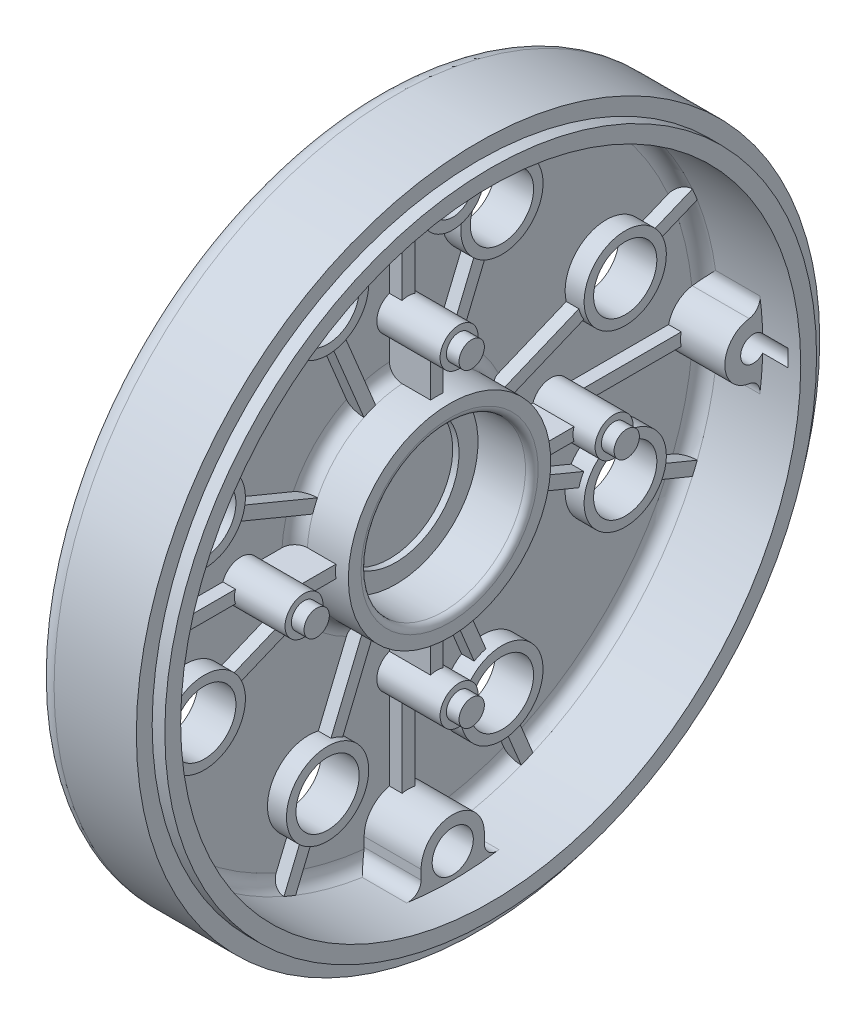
SolidWorks part; units mm, degrees
ref_plane "Plan de face" through (0, 0, 0) normal (0, 0, 1) x (1, 0, 0)
ref_plane "Plan de dessus" through (0, 0, 0) normal (0, 1, 0) x (1, 0, 0)
ref_plane "Plan de droite" through (0, 0, 0) normal (1, 0, 0) x (0, 0, -1)
sketch "Esquisse1" plane through (0, 0, 0) normal (0, 0, 1) x (1, 0, 0)
  line L0 (0, 0) -> (0, 51)
  line L1 (3, 54) -> (16, 54)
  line L2 (16, 54) -> (16, 51.5)
  line L3 (16, 51.5) -> (18, 51.5)
  line L4 (18, 51.5) -> (18, 49)
  line L5 (18, 49) -> (5, 49)
  line L6 (3, 47) -> (3, 18)
  line L7 (5, 16) -> (11.5, 16)
  line L8 (11.5, 16) -> (11.5, 14)
  line L9 (10.5, 13) -> (3, 13)
  line L10 (3, 13) -> (3, 10)
  line L11 (3, 10) -> (2, 10)
  line L12 (2, 10) -> (2, 0)
  line L13 (2, 0) -> (0, 0)
  line L14 (0, 0) -> (60.4258, 0) construction
  arc A0 (0, 51) -> (3, 54) centre (3, 51) cw
  arc A1 (5, 49) -> (3, 47) centre (5, 47) ccw
  arc A2 (3, 18) -> (5, 16) centre (5, 18) ccw
  arc A3 (11.5, 14) -> (10.5, 13) centre (10.5, 14) cw
  point P18 (0, 54)
  dimension "D13" = 3
  dimension "D14" = 2
  dimension "D15" = 1
  dimension "D1" = 108
  dimension "D2" = 103
  dimension "D3" = 16
  dimension "D4" = 18
  dimension "D5" = 15
  dimension "D6" = 6.5
  dimension "D7" = 15
  dimension "D8" = 16
  dimension "D9" = 26
  dimension "D10" = 10
  dimension "D11" = 32
  dimension "D12" = 98
revolve "Révolution1" add sketch "Esquisse1" angle 360 about L14
ref_plane "Plan1" through (12, 0, 0) normal (1, 0, 0) x (0, 0, -1)
sketch "Esquisse2" plane through (12, 0, 0) normal (1, 0, 0) x (0, 0, -1)
  line L0 (-5, 45) -> (-5, 46.4758)
  line L1 (0, 0) -> (0, 45) construction
  line L2 (5, 45) -> (5, 46.4758)
  arc A0 (-5, 45) -> (5, 45) centre (0, 45) ccw
  circle A1 centre (0, 0) radius 49 construction
  arc A2 (7.2979, 48.4535) -> (-7.2979, 48.4535) centre (0, 0) ccw
  arc A3 (-5, 46.4758) -> (-7.2979, 48.4535) centre (-7, 46.4758) ccw
  arc A4 (5, 46.4758) -> (7.2979, 48.4535) centre (7, 46.4758) cw
  point P9 (-5, 48.7442)
  point P12 (5, 48.7442)
  dimension "D1" = 10
  dimension "D2" = 2
  dimension "D3" = 45
extrude "Extrusion1" add sketch "Esquisse2" against normal up to surface (9 mm away)
sketch "Esquisse3" plane through (12, 0, 0) normal (1, 0, 0) x (0, 0, -1)
  circle A0 centre (0, 45) radius 3.25
  dimension "D1" = 6.5
extrude "Enlèv. mat.-Extru.1" cut sketch "Esquisse3" against normal through all
pattern_circular "Répétition circulaire1" count 2 over 360 about axis through (0, 0, 0) along (1, 0, 0) of "Extrusion1", "Enlèv. mat.-Extru.1"
sketch "Esquisse4" plane through (12, 0, 0) normal (1, 0, 0) x (0, 0, -1)
  line L0 (0, 0) -> (-43, 0) construction
  arc A0 (-46.8478, -4.4525) -> (-46.8478, 4.4525) centre (-47.5, 0) ccw
  arc A2 (-48.5391, 6.705) -> (-48.5391, -6.705) centre (0, 0) ccw
  arc A3 (-48.5391, -6.705) -> (-46.8478, -4.4525) centre (-46.5579, -6.4314) cw
  arc A4 (-48.5391, 6.705) -> (-46.8478, 4.4525) centre (-46.5579, 6.4314) ccw
  circle A5 centre (0, 0) radius 49 construction
  dimension "D1" = 9
  dimension "D3" = 2
  dimension "D2" = 47.5
extrude "Extrusion2" add sketch "Esquisse4" against normal up to surface (9 mm away)
hole_wizard "Trou taraudé M51" positions "Esquisse8" profile "Esquisse7" tap size "M5" standard "ISO"
sketch "Esquisse8" plane through (16, 0, 0) normal (1, 0, 0) x (0, 0, -1)
  arc A0 (-46.8478, -4.4525) -> (-46.8478, 4.4525) centre (-47.5, 0) ccw construction
  point P0 (-47.5, 0)
sketch "Esquisse7" plane through (16, 0, 47.5) normal (0, 1, 0) x (0, 0, -1)
  line L0 (0, 0) -> (0, 16)
  line L1 (0, 16) -> (2, 16)
  line L2 (2, 16) -> (2, 0)
  line L5 (2, 0) -> (0, 0)
  line L11 (0, -6.35) -> (0, 107.95) construction
  dimension "Diamètre du trou pour taraudage jusqu'au prochain" = 4
  dimension "Profondeur du trou pour taraudage jusqu'au prochain" = 16
pattern_circular "Répétition circulaire2" count 2 over 360 about axis through (0, 0, 0) along (1, 0, 0) of "Trou taraudé M51", "Extrusion2"
ref_plane "Plan2" through (5, 0, 0) normal (1, 0, 0) x (0, 0, -1)
sketch "Esquisse11" plane through (5, 0, 0) normal (1, 0, 0) x (0, 0, -1)
  line L0 (0, 0) -> (0, 45) construction
  line L1 (0, 0) -> (-20.6649, 49.8895) construction
  line L2 (-18.7515, 45.2701) -> (-6.1229, 14.7821)
  line L3 (18.7515, 45.2701) -> (6.1229, 14.7821)
  line L4 (45.2701, 18.7515) -> (14.7821, 6.1229)
  line L5 (45.2701, -18.7515) -> (14.7821, -6.1229)
  line L6 (18.7515, -45.2701) -> (6.1229, -14.7821)
  line L7 (-18.7515, -45.2701) -> (-6.1229, -14.7821)
  line L8 (-45.2701, -18.7515) -> (-14.7821, -6.1229)
  line L9 (-45.2701, 18.7515) -> (-14.7821, 6.1229)
  circle A0 centre (0, 0) radius 54 construction
  arc A1 (-7.2979, 48.4535) -> (-48.5391, 6.705) centre (0, 0) ccw construction
  circle A2 centre (0, 0) radius 16 construction
  dimension "D1" = 22.5
rib "Nervure1" sketch "Esquisse11" sketch "Esquisse11" thickness 2 extrusion direction normal to sketch draft on no parameters "D1"=2
sketch "Esquisse9" plane through (3, 0, 0) normal (1, 0, 0) x (0, 0, -1)
  line L0 (0, 0) -> (0, 45) construction
  line L1 (0, 0) -> (-20.6649, 49.8895) construction
  circle A0 centre (0, 0) radius 54 construction
  circle A1 centre (-13.7766, 33.2597) radius 6.5
  dimension "D2" = 13
  dimension "D1" = 22.5
  dimension "D3" = 36
extrude "Extrusion3" add sketch "Esquisse9" along normal blind 3
sketch "Esquisse10" plane through (6, 0, 0) normal (1, 0, 0) x (0, 0, -1)
  circle A0 centre (-13.7766, 33.2597) radius 5
  dimension "D1" = 10
extrude "Enlèv. mat.-Extru.2" cut sketch "Esquisse10" against normal through all
pattern_circular "Répétition circulaire3" count 8 over 360 about axis through (0, 0, 0) along (1, 0, 0) of "Enlèv. mat.-Extru.2", "Extrusion3"
sketch "Esquisse12" plane through (5, 0, 0) normal (1, 0, 0) x (0, 0, -1)
  line L0 (0, 40) -> (0, 16)
  line L1 (-43, 0) -> (-16, 0)
  line L2 (0, -40) -> (0, -16)
  line L3 (16, 0) -> (43, 0)
  arc A0 (-5, 45) -> (5, 45) centre (0, 45) ccw construction
  arc A1 (-5, 45) -> (5, 45) centre (0, 45) ccw construction
  circle A2 centre (0, 0) radius 16 construction
  arc A3 (-46.7895, -4.4436) -> (-46.7895, 4.4436) centre (-47.5, 0) ccw construction
  arc A4 (-15.1359, 5.1871) -> (-15.1359, -5.1871) centre (0, 0) ccw construction
  arc A5 (5, -45) -> (-5, -45) centre (0, -45) ccw construction
  arc A6 (15.1359, -5.1871) -> (15.1359, 5.1871) centre (0, 0) ccw construction
  arc A7 (46.8478, 4.4525) -> (46.8478, -4.4525) centre (47.5, 0) ccw construction
rib "Nervure2" sketch "Esquisse12" sketch "Esquisse12" thickness 2 extrusion direction normal to sketch draft on no parameters "D1"=2
sketch "Esquisse13" plane through (3, 0, 0) normal (1, 0, 0) x (0, 0, -1)
  line L0 (0, 0) -> (0, 39.8121) construction
  circle A0 centre (0, 24.5) radius 3
  dimension "D2" = 6
  dimension "D1" = 24.5
extrude "Extrusion4" add sketch "Esquisse13" along normal blind 10
sketch "Esquisse14" plane through (13, 0, 0) normal (1, 0, 0) x (0, 0, -1)
  circle A0 centre (0, 24.5) radius 2
  dimension "D1" = 4
extrude "Extrusion5" add sketch "Esquisse14" along normal blind 2
pattern_circular "Répétition circulaire4" count 4 over 360 about axis through (0, 0, 0) along (1, 0, 0) of "Extrusion4", "Extrusion5"
ref_plane "Plan3" through (9.5, 0, 0) normal (1, 0, 0) x (0, 0, -1)
sketch "Esquisse15" plane through (9.5, 0, 0) normal (1, 0, 0) x (0, 0, -1)
  line L0 (0, 16) -> (0, 21.5)
  line L1 (-16, 0) -> (-21.5, 0)
  line L2 (0, -16) -> (0, -21.5)
  line L3 (16, 0) -> (21.5, 0)
  arc A0 (1, 15.9687) -> (-1, 15.9687) centre (0, 0) ccw construction
  circle A1 centre (0, 0) radius 16 construction
  arc A2 (-1, 21.6716) -> (1, 21.6716) centre (0, 24.5) ccw construction
  arc A3 (-15.9687, 1) -> (-15.9687, -1) centre (0, 0) ccw construction
  arc A4 (-21.6716, -1) -> (-21.6716, 1) centre (-24.5, 0) ccw construction
  arc A5 (1, -21.6716) -> (-1, -21.6716) centre (0, -24.5) ccw construction
  arc A6 (15.9687, -1) -> (15.9687, 1) centre (0, 0) ccw construction
  arc A7 (21.6716, 1) -> (21.6716, -1) centre (24.5, 0) ccw construction
rib "Nervure3" sketch "Esquisse15" sketch "Esquisse15" thickness 2 extrusion direction normal to sketch draft on no parameters "D1"=2
